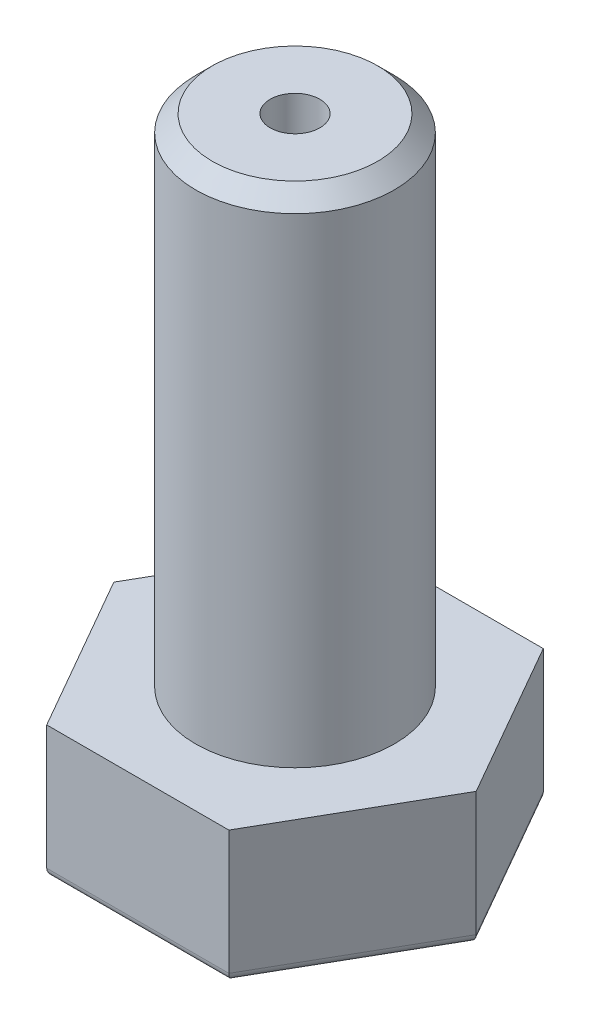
SolidWorks part; units mm, degrees
ref_plane "Plan de face" through (0, 0, 0) normal (0, 0, 1) x (1, 0, 0)
ref_plane "Plan de dessus" through (0, 0, 0) normal (0, 1, 0) x (1, 0, 0)
ref_plane "Plan de droite" through (0, 0, 0) normal (1, 0, 0) x (0, 0, -1)
sketch "Esquisse1" plane through (0, 0, 0) normal (0, 1, 0) x (1, 0, 0)
  line L0 (-10.95, 0) -> (10.95, 0) construction
  line L1 (0, -9.5) -> (0, 9.5) construction
  line L2 (-5.5046, 9.5) -> (5.5046, 9.5)
  line L3 (5.5046, 9.5) -> (10.95, 0)
  line L4 (-5.5046, 9.5) -> (-10.95, 0)
  line L5 (-5.5046, -9.5) -> (-10.95, 0)
  line L6 (5.5046, -9.5) -> (10.95, 0)
  line L7 (-5.5046, -9.5) -> (5.5046, -9.5)
  point P8 (0, 0)
  dimension "D1" = 19
  dimension "D2" = 19
  dimension "D3" = 21.9
extrude "Extrusion1" add sketch "Esquisse1" along normal blind 8
fillet "Congé1" radius 0.5 6 edges at (-8.2273, 0, 4.75) (-8.2273, 0, -4.75) (0, 0, -9.5) (8.2273, 0, -4.75) (8.2273, 0, 4.75) (0, 0, 9.5)
sketch "Esquisse2" plane through (0, 8, 0) normal (0, 1, 0) x (-1, 0, 0)
  circle A0 centre (0, 0) radius 6
  dimension "D1" = 12
extrude "Extrusion2" add sketch "Esquisse2" along normal blind 30
chamfer "Chanfrein1" distance 1 angle 45 1 edges at (0, 38, 6)
hole_wizard "Diamètre du perçage Ø3.0 (3)1" positions "Esquisse3D1" profile "Esquisse3" hole size "Ø3.0" standard "ISO"
sketch3d "Esquisse3D1"
  line L0 (0, 37, 0) -> (0, 38, 0) construction
  point P0 (0, 0, 0)
  point P4 (0, 38, 0)
sketch "Esquisse3" plane through (0, 38, 0) normal (1, 0, 0) x (0, 0, 1)
  line L0 (0, 0) -> (0, 38)
  line L1 (0, 38) -> (1.5, 38)
  line L2 (1.5, 38) -> (1.5, 0)
  line L5 (1.5, 0) -> (0, 0)
  line L11 (0, -6.35) -> (0, 107.95) construction
  dimension "Diamètre du perçage jusqu'au prochain" = 3
  dimension "Profondeur du perçage jusqu'au prochain" = 38
hole_wizard "Trou taraudé M8x1.251" positions "Esquisse3D2" profile "Esquisse4" tap size "M8x1.25" standard "Ansi Métrique"
sketch3d "Esquisse3D2"
  circle A0 centre (0, 0, 0) radius 1.5 construction
  point P0 (0, 0, 0)
  point P6 (0, 1.5, 0)
sketch "Esquisse4" plane through (0, 0, 0) normal (1, 0, 0) x (0, 0, -1)
  line L0 (0, 0) -> (0, 11.7929)
  line L1 (0, 11.7929) -> (3.4, 9.75)
  line L2 (3.4, 9.75) -> (3.4, 6)
  line L3 (3.4, 6) -> (4, 6)
  line L4 (4, 6) -> (4, 0)
  line L5 (4, 0) -> (0, 0)
  line L10 (0, 11.7929) -> (-3.4, 9.75) construction
  line L11 (0, -6.35) -> (0, 107.95) construction
  dimension "Diamètre du trou pour taraudage" = 6.8
  dimension "Profondeur du trou pour taraudage" = 9.75
  dimension "Diamètre principal du filetage" = 8
  dimension "Profondeur du filetage" = 6
  dimension "Angle de pointe" = 118
